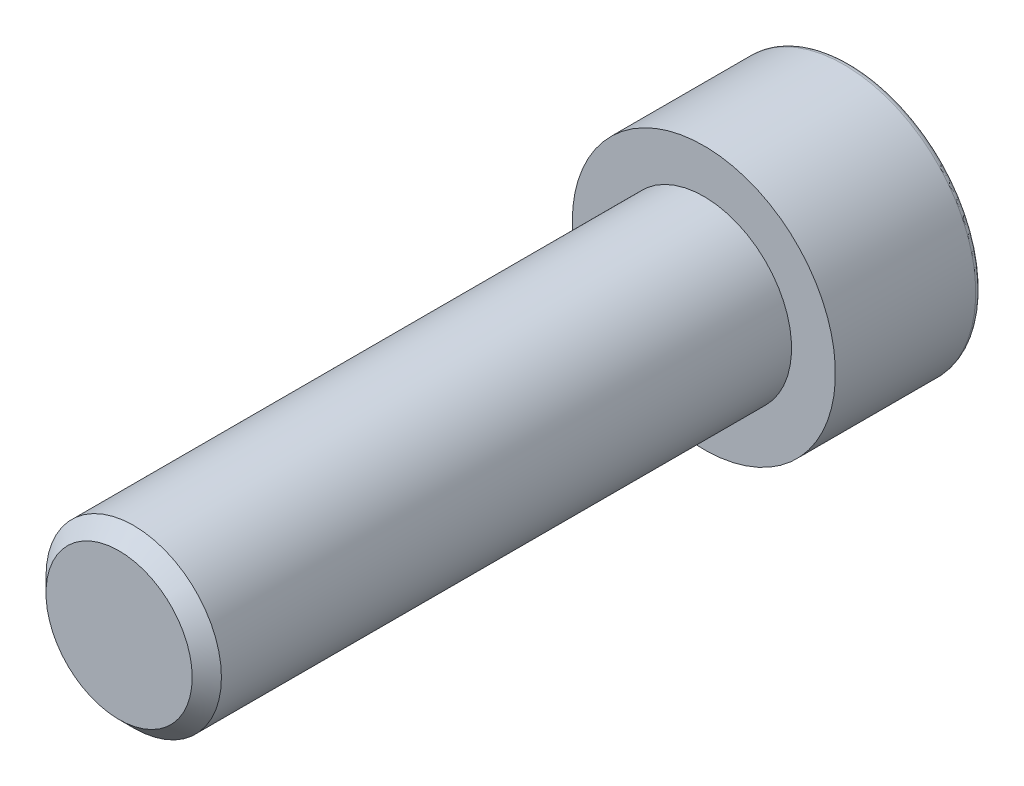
SolidWorks part; units mm, degrees
ref_plane "Plan de face" through (0, 0, 0) normal (0, 0, 1) x (1, 0, 0)
ref_plane "Plan de dessus" through (0, 0, 0) normal (0, 1, 0) x (1, 0, 0)
ref_plane "Plan de droite" through (0, 0, 0) normal (1, 0, 0) x (0, 0, -1)
sketch "Esquisse1" plane through (0, 0, 0) normal (0, 0, 1) x (1, 0, 0)
  circle A0 centre (0, 0) radius 3
  dimension "D1" = 6
extrude "Boss.-Extru.1" add sketch "Esquisse1" along normal blind 20
chamfer "Chanfrein1" distance 0.5 angle 45 1 edges at (3, 0, 20)
sketch "Esquisse2" plane through (0, 0, 0) normal (0, 0, -1) x (-1, 0, 0)
  circle A0 centre (0, 0) radius 4.5
  dimension "D1" = 9
extrude "Boss.-Extru.2" add sketch "Esquisse2" along normal blind 5
sketch "Esquisse3" plane through (0, 0, -5) normal (0, 0, -1) x (-1, 0, 0)
  line L1 (2.7177, 0) -> (1.3588, 2.3536)
  line L2 (1.3588, 2.3536) -> (-1.3588, 2.3536)
  line L3 (-1.3588, 2.3536) -> (-2.7177, 0)
  line L4 (-2.7177, 0) -> (-1.3588, -2.3536)
  line L5 (-1.3588, -2.3536) -> (1.3588, -2.3536)
  line L6 (1.3588, -2.3536) -> (2.7177, 0)
  circle A0 centre (0, 0) radius 2.3536 construction
extrude "Enlèv. mat.-Extru.1" cut sketch "Esquisse3" against normal blind 2
fillet "Congé1" radius 0.2 1 edges at (-4.5, 0, -5)
